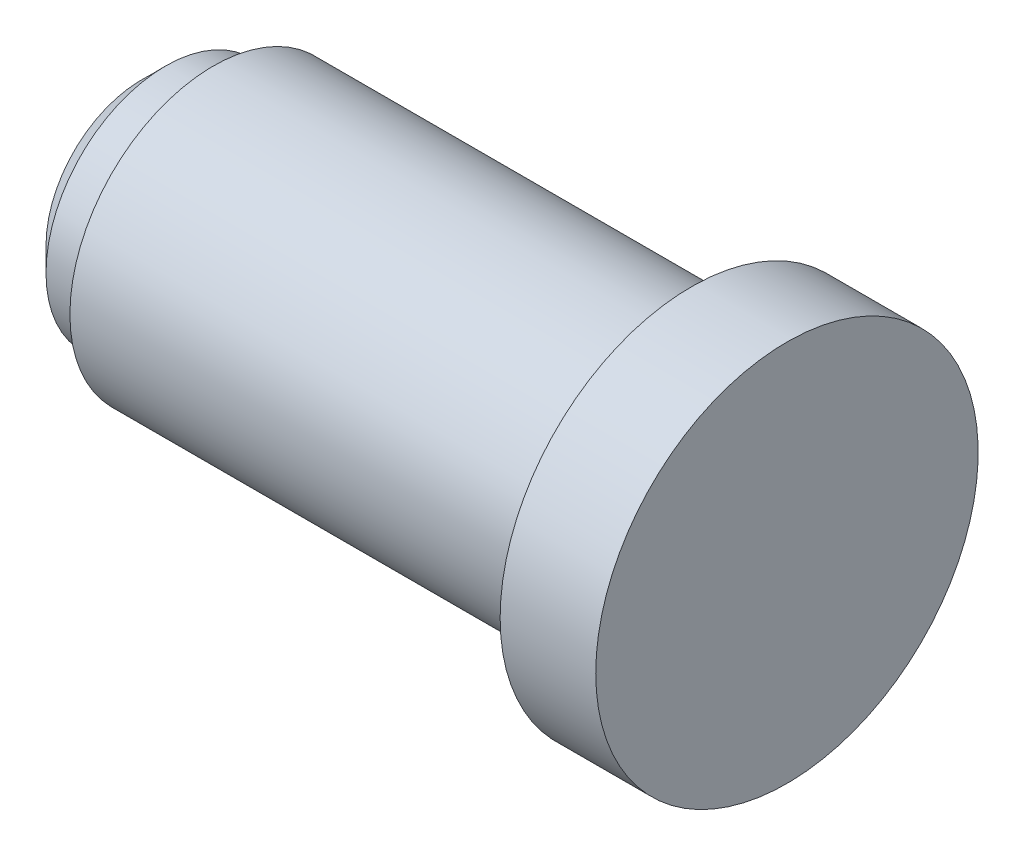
SolidWorks part; units mm, degrees
ref_plane "Plan de face" through (0, 0, 0) normal (0, 0, 1) x (1, 0, 0)
ref_plane "Plan de dessus" through (0, 0, 0) normal (0, 1, 0) x (1, 0, 0)
ref_plane "Plan de droite" through (0, 0, 0) normal (1, 0, 0) x (0, 0, -1)
sketch "Esquisse1" plane through (0, 0, 0) normal (0, 0, 1) x (1, 0, 0)
  line L0 (-45.1981, 0) -> (-31.6981, 0)
  line L1 (-31.6981, 0) -> (-31.6981, 4)
  line L2 (-31.6981, 4) -> (-33.6981, 4)
  line L3 (-33.6981, 4) -> (-33.6981, 3)
  line L4 (-33.6981, 3) -> (-43.6981, 3)
  line L5 (-43.6981, 3) -> (-43.6981, 2.5)
  line L6 (-43.6981, 2.5) -> (-44.6981, 2.5)
  line L7 (-45.1981, 0) -> (-45.1981, 2)
  line L8 (-45.1981, 2) -> (-44.6981, 2.5)
  dimension "D1" = 1.5
  dimension "D2" = 10
  dimension "D3" = 3
  dimension "D4" = 2
  dimension "D5" = 4
  dimension "D6" = 2.5
  dimension "D7" = 2
  dimension "D8" = 135
revolve "Révolution1" add sketch "Esquisse1" angle 360 about L0
